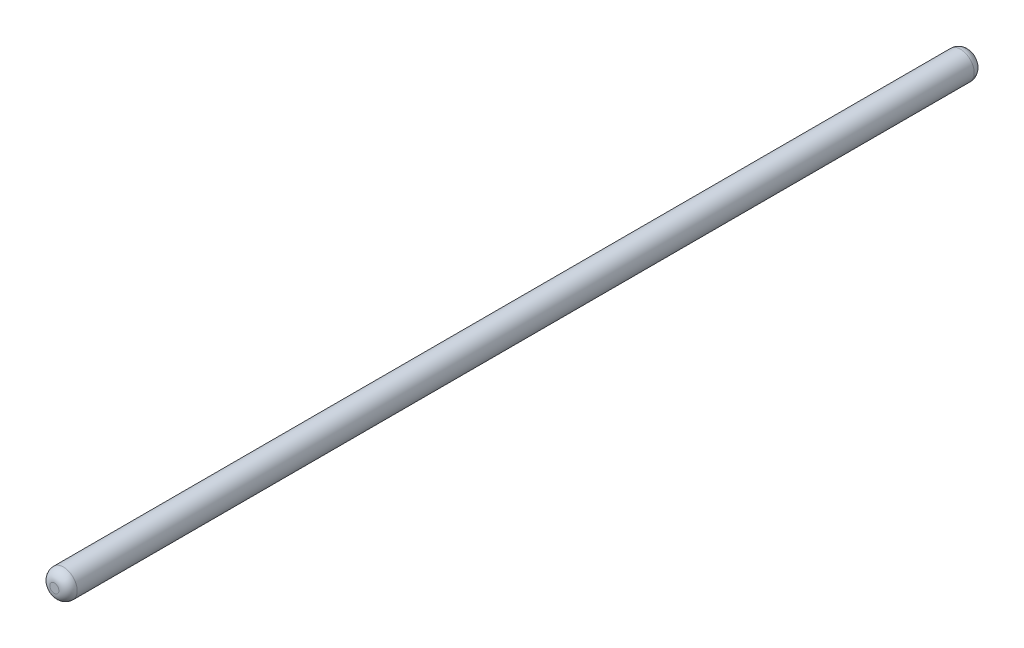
SolidWorks part; units mm, degrees
ref_plane "Alzado" through (0, 0, 0) normal (0, 0, 1) x (1, 0, 0)
ref_plane "Planta" through (0, 0, 0) normal (0, 1, 0) x (1, 0, 0)
ref_plane "Vista lateral" through (0, 0, 0) normal (1, 0, 0) x (0, 0, -1)
sketch "Croquis1" plane through (0, 0, 0) normal (0, 0, 1) x (1, 0, 0)
  circle A0 centre (0, 0) radius 1.5
  dimension "D1" = 3
extrude "Saliente-Extruir1" add sketch "Croquis1" along normal mid plane 100
fillet "Redondeo1" radius 1 2 edges at (1.5, 0, -50) (1.5, 0, 50)
